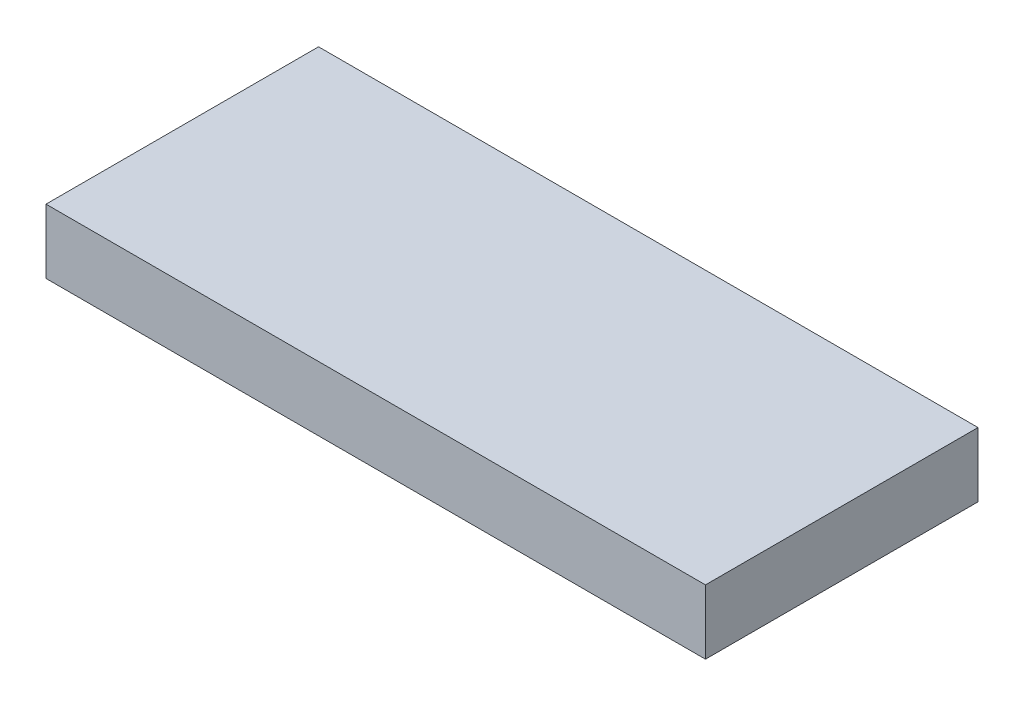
SolidWorks part; units mm, degrees
ref_plane "Front Plane" through (0, 0, 0) normal (0, 0, 1) x (1, 0, 0)
ref_plane "Top Plane" through (0, 0, 0) normal (0, 1, 0) x (1, 0, 0)
ref_plane "Right Plane" through (0, 0, 0) normal (1, 0, 0) x (0, 0, -1)
sketch "Sketch1" plane through (0, 0, 0) normal (0, 1, 0) x (1, 0, 0)
  line L1 (15.365, -6.35) -> (-15.365, -6.35)
  line L2 (15.365, -6.35) -> (15.365, 6.35)
  line L3 (15.365, 6.35) -> (-15.365, 6.35)
  line L4 (-15.365, -6.35) -> (-15.365, 6.35)
  line L5 (15.365, -6.35) -> (-15.365, 6.35) construction
  line L6 (15.365, 6.35) -> (-15.365, -6.35) construction
  point P0 (0, 0)
  dimension "D1" = 12.7
  dimension "D2" = 30.73
extrude "Boss-Extrude1" add sketch "Sketch1" along normal blind 3
